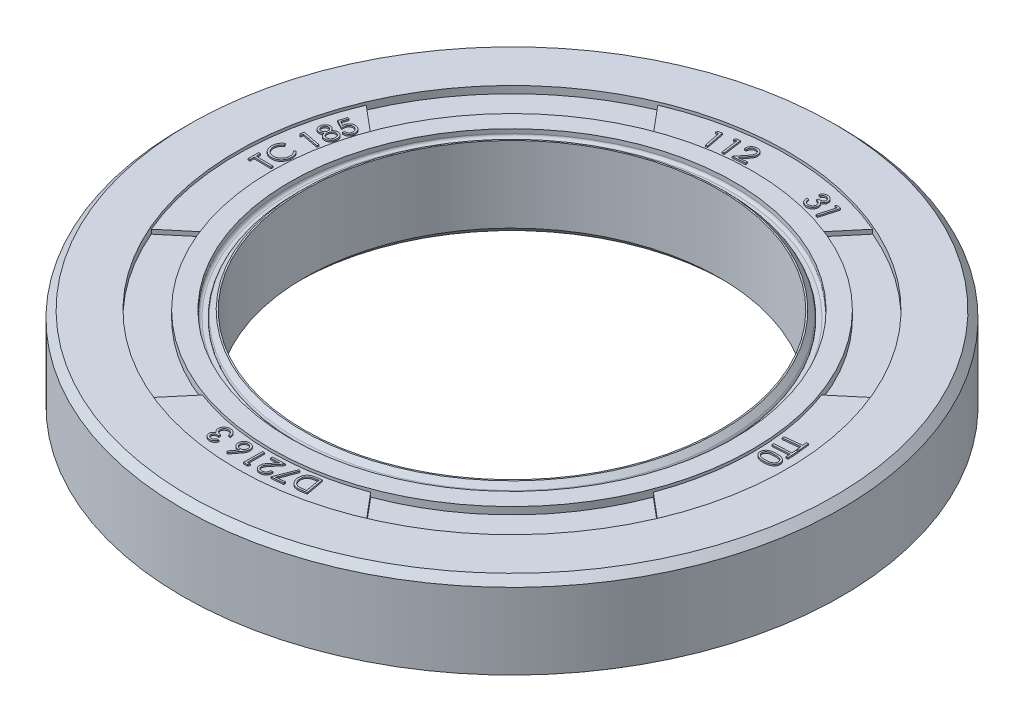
SolidWorks part; units mm, degrees
ref_plane "Front Plane" through (0, 0, 0) normal (0, 0, 1) x (1, 0, 0)
ref_plane "Top Plane" through (0, 0, 0) normal (0, 1, 0) x (1, 0, 0)
ref_plane "Right Plane" through (0, 0, 0) normal (1, 0, 0) x (0, 0, -1)
sketch "Sketch1" plane through (0, 0, 0) normal (0, 1, 0) x (1, 0, 0)
  circle A0 centre (0, 0) radius 23
  dimension "D1" = 46
extrude "Extrude1" add sketch "Sketch1" along normal blind 5.8
sketch "Sketch2" plane through (0, 5.8, 0) normal (0, 1, 0) x (1, 0, 0)
  circle A0 centre (0, 0) radius 14.5
  dimension "D1" = 29
extrude "Extrude2" cut sketch "Sketch2" against normal through all
sketch "Sketch3" plane through (0, 0, 0) normal (0, -1, 0) x (1, 0, 0)
  circle A0 centre (0, 0) radius 17.3
  circle A1 centre (0, 0) radius 20.8
  circle A2 centre (0, 0) radius 14.5 construction
  dimension "D1" = 2.8
  dimension "D2" = 3.5
extrude "Extrude3" cut sketch "Sketch3" against normal blind 4.3
sketch "Sketch4" plane through (0, 4.3, 0) normal (0, -1, 0) x (1, 0, 0)
  line L0 (-4, 20.4118) -> (-2.1276, 17.1687)
  line L1 (4, 20.4118) -> (2.1276, 17.1687)
  line L2 (0, 0) -> (0, 20.8) construction
  circle A0 centre (0, 0) radius 20.8 construction
  circle A1 centre (0, 0) radius 17.3 construction
  arc A2 (2.1276, 17.1687) -> (-2.1276, 17.1687) centre (0, 0) ccw
  arc A3 (4, 20.4118) -> (-4, 20.4118) centre (0, 0) ccw
  dimension "D1" = 60
  dimension "D2" = 8
extrude "Extrude4" cut sketch "Sketch4" against normal blind 0.5
pattern_circular "CirPattern1" count 6 over 360 about axis through (0, 0, 0) along (0, 1, 0) of "Extrude4"
sketch "Sketch5" plane through (0, 5.8, 0) normal (0, 1, 0) x (1, 0, 0)
  circle A0 centre (0, 0) radius 15
  circle A1 centre (0, 0) radius 15.5
  circle A2 centre (0, 0) radius 16.8
  circle A3 centre (0, 0) radius 19.2
  circle A4 centre (0, 0) radius 14.5 construction
  dimension "D1" = 0.5
  dimension "D2" = 0.5
  dimension "D3" = 1.3
  dimension "D4" = 2.4
extrude "Extrude5" cut sketch "Sketch5" against normal blind 0.5 contours A1 A0 | A3 A2
chamfer "Chamfer1" distance 0.4 angle 45 1 edges at (0, 5.8, 15)
fillet "Fillet1" radius 0.2 2 edges at (0, 5.3, 15.5) (0, 5.4, 15)
chamfer "Chamfer2" distance 0.5 angle 45 1 edges at (0, 5.8, 23)
chamfer "Chamfer3" distance 0.5 angle 45 1 edges at (0, 0, 14.5)
sketch "Sketch6" plane through (0, 5.3, 0) normal (0, 1, 0) x (1, 0, 0)
  line L0 (-7.5, 17.6746) -> (-5.8758, 15.739)
  line L1 (5.8758, 15.739) -> (7.5, 17.6746)
  line L2 (0, 0) -> (0, 19.2) construction
  circle A0 centre (0, 0) radius 19.2 construction
  circle A1 centre (0, 0) radius 16.8 construction
  circle A2 centre (0, 0) radius 16.8 construction
  arc A3 (5.8758, 15.739) -> (-5.8758, 15.739) centre (0, 0) ccw
  arc A4 (7.5, 17.6746) -> (-7.5, 17.6746) centre (0, 0) ccw
  dimension "D1" = 80
  dimension "D2" = 15
extrude "Extrude6" add sketch "Sketch6" along normal blind 0.3
pattern_circular "CirPattern2" count 4 over 360 about axis through (0, 0, 0) along (0, 1, 0) of "Extrude6"
sketch "Sketch7" plane through (0, 5.6, 0) normal (0, 1, 0) x (-1, 0, 0)
  circle A0 centre (0, 0) radius 17.1547 construction
  text T0 "TC 185                                  112        31                                      TT0                                             D7216 3                                         " font "Century Gothic" height in points 5
extrude "Extrude11" add sketch "Sketch7" along normal blind 0.1
